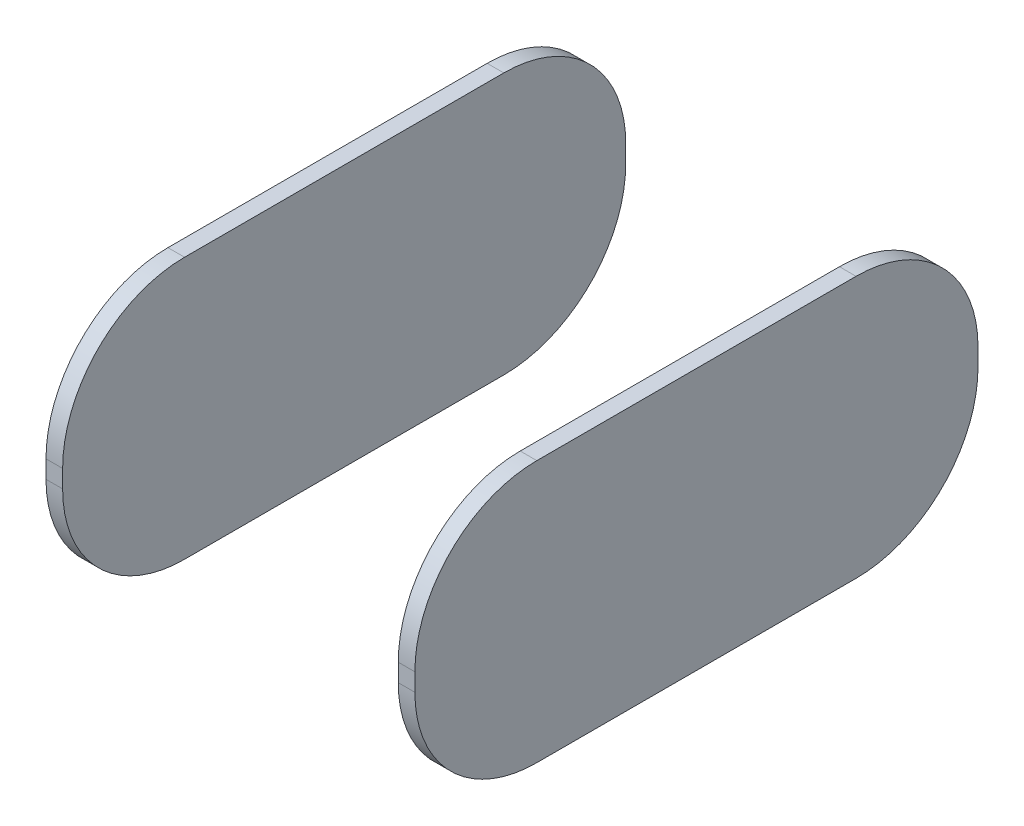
SolidWorks part; units mm, degrees
ref_plane "Plan de face" through (0, 0, 0) normal (0, 0, 1) x (1, 0, 0)
ref_plane "Plan de dessus" through (0, 0, 0) normal (0, 1, 0) x (1, 0, 0)
ref_plane "Plan de droite" through (0, 0, 0) normal (1, 0, 0) x (0, 0, -1)
sketch "Esquisse1" plane through (0, 0, 0) normal (0, 0, 1) x (1, 0, 0)
  line L1 (-8.32, 5.9) -> (-7.57, 5.9)
  line L2 (-8.32, 5.9) -> (-8.32, -5.9)
  line L3 (-8.32, -5.9) -> (-7.57, -5.9)
  line L4 (-7.57, 5.9) -> (-7.57, -5.9)
  line L5 (7.57, 5.9) -> (8.32, 5.9)
  line L6 (7.57, 5.9) -> (7.57, -5.9)
  line L7 (7.57, -5.9) -> (8.32, -5.9)
  line L8 (8.32, 5.9) -> (8.32, -5.9)
  dimension "D1" = 0.75
  dimension "D2" = 15.14
  dimension "D3" = 0.75
  dimension "D4" = 11.8
  dimension "D5" = 7.57
  dimension "D6" = 5.9
extrude "Extrusion1" add sketch "Esquisse1" along normal mid plane 25.4
fillet "Congé1" radius 5.5 4 edges at (-7.945, -5.9, 12.7) (-7.945, 5.9, 12.7) (-7.945, -5.9, -12.7) (-7.945, 5.9, -12.7)
fillet "Congé2" radius 5.5 4 edges at (7.945, -5.9, -12.7) (7.945, 5.9, -12.7) (7.945, -5.9, 12.7) (7.945, 5.9, 12.7)
sketch "Esquisse2" plane through (8.32, 0, 0) normal (1, 0, 0) x (0, 0, -1)
  circle A0 centre (-6.35, 0) radius 0.5
  circle A1 centre (6.35, 0) radius 0.5
  dimension "D1" = 1
  dimension "D2" = 12.7
  dimension "D3" = 6.35
